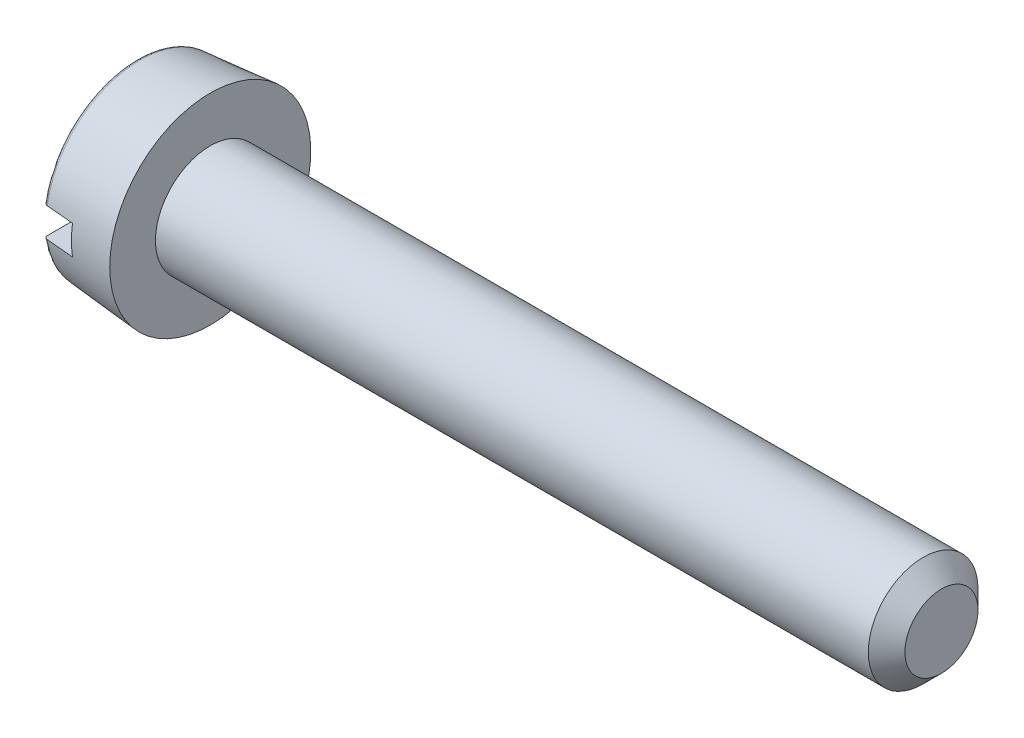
SolidWorks part; units mm, degrees
ref_plane "Plane1" through (0, 0, 0) normal (0, 0, 1) x (1, 0, 0)
ref_plane "Plane2" through (0, 0, 0) normal (0, 1, 0) x (1, 0, 0)
ref_plane "Plane3" through (0, 0, 0) normal (1, 0, 0) x (0, 0, -1)
revolve "Base-Revolve" add sketch "BodySke"
sketch "BodySke" plane through (0, 0, 0) normal (0, 0, 1) x (1, 0, 0)
  line L0 (2, 1.5) -> (2, 2.75)
  line L1 (0, 0) -> (0, 2.575)
  line L2 (-25.4, 0) -> (127, 0) construction
  line L3 (22, 0) -> (0, 0)
  line L4 (2, 1.5) -> (22, 1.5)
  line L5 (22, 1.5) -> (22, 0)
  line L6 (0, 2.575) -> (2, 2.75)
  line L9 (2.5, 3.0875) -> (2.5, -6.4375) construction
  line L10 (2, 6.35) -> (2, -3.175) construction
  dimension "Head_ht" = 2
  dimension "Diameter" = 3
  dimension "Length" = 20
  dimension "Head_dia" = 5.5
  dimension "Advance" = 0.5
  dimension "Thread_nom" = 20
  dimension "Head_side_angle" = 5
fillet "Fillet1" [suppressed] radius 0.1
fillet "Fillet2" radius 0.1
sketch "Sketch2" plane through (0, 0, 0) normal (1, 0, 0) x (0, 0, -1)
  line L0 (2.75, -0.4) -> (-2.75, -0.4)
  line L1 (2.75, -0.4) -> (2.75, 0.4)
  line L2 (-2.75, 0.4) -> (2.75, 0.4)
  line L3 (-2.75, 0.4) -> (-2.75, -0.4)
  dimension "D1" = 5.5
  dimension "D2" = 2.75
  dimension "Slot_width" = 0.8
  dimension "D3" = 0.4
extrude "Slot" cut sketch "Sketch2" along normal blind 0.85
sketch "ThdSchSke" plane through (0, 0, 0) normal (0, 0, 1) x (1, 0, 0)
  line L0 (3, -1.2195) -> (2.8036, -1.5)
  line L1 (3, -1.2195) -> (3.1964, -1.5)
  line L2 (3.1964, -1.5) -> (3.1964, -1.875)
  line L3 (-3.175, 0) -> (5.1513, 0) construction
  line L5 (3.1964, -1.875) -> (2.8036, -1.875)
  line L6 (2.8036, -1.875) -> (2.8036, -1.5)
  dimension "Thread_minor" = 2.439
  dimension "Diameter" = 3
  dimension "Start" = 3
  dimension "SideAngle" = 55
  dimension "VeeAngle" = 70
  dimension "Overcut" = 3.75
revolve "ThreadSchematic" [suppressed] cut sketch "ThdSchSke" angle 360 about L3
pattern_linear "ThdSchPat" [suppressed]
chamfer "Chanfrein1" distance 0.5 angle 45
equation "\"D1@Sketch2\" = \"Head_dia@BodySke\""
equation "\"D2@Sketch2\" = \"D1@Sketch2\" / 2"
equation "\"D3@Sketch2\" = \"Slot_width@Sketch2\" / 2"
equation "\"Thread_length@ThreadCosmetic\" = ((sgn( (\"Length@BodySke\" - \"Advance@BodySke\" * 2.0 ) - \"Thread_nom@BodySke\" )-1)*( (\"Length@BodySke\" - \"Advance@BodySke\"  * 2.0) - \"Thread_nom@BodySke\" ))/-2+ \"Thread_"
equation "\"Thread_minor@ThdSchSke\" = \"Thread_minor@ThreadCosmetic\""
equation "\"Diameter@ThdSchSke\" = \"Diameter@BodySke\""
equation "\"Overcut@ThdSchSke\" = \"Diameter@BodySke\" * 1.25"
equation "\"Start@ThdSchSke\" = \"Head_ht@BodySke\" + \"Length@BodySke\" - \"Thread_length@ThreadCosmetic\"  '---Non-countersunk---"
equation "\"Num_threads@ThdSchPat\" = int( \"Thread_length@ThreadCosmetic\" / \"Advance@BodySke\" + 0.999 )  + 1"
equation "\"Advance@ThdSchPat\" = \"Thread_length@ThreadCosmetic\" /  (\"Num_threads@ThdSchPat\" - 1) 'relax it"
